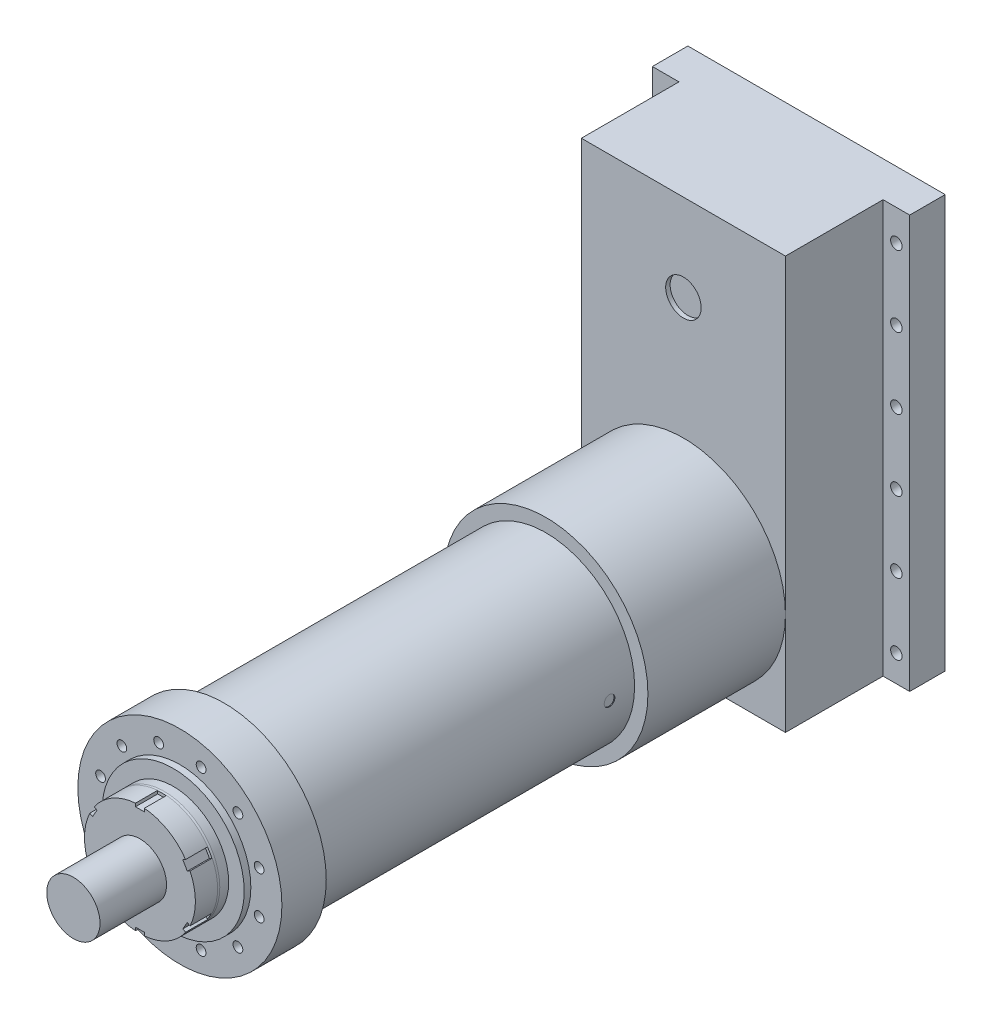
SolidWorks part; units mm, degrees
ref_plane "前视基准面" through (0, 0, 0) normal (0, 0, 1) x (1, 0, 0)
ref_plane "上视基准面" through (0, 0, 0) normal (0, 1, 0) x (1, 0, 0)
ref_plane "右视基准面" through (0, 0, 0) normal (1, 0, 0) x (0, 0, -1)
sketch "草图1" plane through (0, 0, 0) normal (0, 0, 1) x (1, 0, 0)
  circle A0 centre (0, 0) radius 200
  dimension "D1" = 400
extrude "凸台-拉伸1" add sketch "草图1" along normal blind 725
sketch "草图2" plane through (0, 0, 725) normal (0, 0, 1) x (1, 0, 0)
  line L0 (0, 0) -> (351.3656, 0) construction
  line L1 (0, 0) -> (299.4379, 80.2342) construction
  circle A0 centre (0, 0) radius 230
  circle A1 centre (0, 0) radius 185 construction
  circle A2 centre (178.6963, 47.8815) radius 11
  circle A3 centre (178.6963, -47.8815) radius 11
  circle A4 centre (130.8148, -130.8148) radius 11
  circle A5 centre (47.8815, -178.6963) radius 11
  circle A6 centre (-47.8815, -178.6963) radius 11
  circle A7 centre (-130.8148, -130.8148) radius 11
  circle A8 centre (-178.6963, -47.8815) radius 11
  circle A9 centre (-178.6963, 47.8815) radius 11
  circle A10 centre (-130.8148, 130.8148) radius 11
  circle A11 centre (-47.8815, 178.6963) radius 11
  circle A12 centre (47.8815, 178.6963) radius 11
  circle A13 centre (130.8148, 130.8148) radius 11
  point P32 (0, 0)
  dimension "D1" = 460
  dimension "D2" = 370
  dimension "D4" = 22
  dimension "D3" = 15
  dimension "D5" = 12
extrude "凸台-拉伸2" add sketch "草图2" along normal blind 100
sketch "草图3" plane through (0, 0, 825) normal (0, 0, 1) x (1, 0, 0)
  circle A0 centre (0, 0) radius 160
  dimension "D1" = 320
extrude "凸台-拉伸3" add sketch "草图3" along normal blind 15
sketch "草图4" plane through (0, 0, 840) normal (0, 0, 1) x (1, 0, 0)
  circle A1 centre (0, 0) radius 125
  dimension "D1" = 250
extrude "凸台-拉伸4" add sketch "草图4" along normal blind 25
chamfer "倒角1" distance 5 angle 10 1 edges at (125, 0, 865)
sketch "草图5" plane through (0, 0, 865) normal (0, 0, 1) x (1, 0, 0)
  line L0 (-10, 124.5994) -> (-10, 117.5)
  line L1 (-10, 117.5) -> (10, 117.5)
  line L2 (10, 117.5) -> (10, 124.5994)
  line L3 (102.9062, 70.9599) -> (96.758, 67.4103)
  line L4 (96.758, 67.4103) -> (106.758, 50.0897)
  line L5 (106.758, 50.0897) -> (112.9062, 53.6394)
  line L6 (112.9062, -53.6394) -> (106.758, -50.0897)
  line L7 (106.758, -50.0897) -> (96.758, -67.4103)
  line L8 (96.758, -67.4103) -> (102.9062, -70.9599)
  line L9 (10, -124.5994) -> (10, -117.5)
  line L10 (10, -117.5) -> (-10, -117.5)
  line L11 (-10, -117.5) -> (-10, -124.5994)
  line L12 (-102.9062, -70.9599) -> (-96.758, -67.4103)
  line L13 (-96.758, -67.4103) -> (-106.758, -50.0897)
  line L14 (-106.758, -50.0897) -> (-112.9062, -53.6394)
  line L15 (-112.9062, 53.6394) -> (-106.758, 50.0897)
  line L16 (-106.758, 50.0897) -> (-96.758, 67.4103)
  line L17 (-96.758, 67.4103) -> (-102.9062, 70.9599)
  arc A0 (-10, 124.5994) -> (-102.9062, 70.9599) centre (0, 0) ccw
  arc A1 (-112.9062, 53.6394) -> (-112.9062, -53.6394) centre (0, 0) ccw
  arc A2 (-102.9062, -70.9599) -> (-10, -124.5994) centre (0, 0) ccw
  arc A3 (10, -124.5994) -> (102.9062, -70.9599) centre (0, 0) ccw
  arc A4 (112.9062, -53.6394) -> (112.9062, 53.6394) centre (0, 0) ccw
  arc A5 (102.9062, 70.9599) -> (10, 124.5994) centre (0, 0) ccw
  point P28 (0, 0)
  dimension "D1" = 250
  dimension "D2" = 20
  dimension "D3" = 10
  dimension "D4" = 117.5
  dimension "D5" = 6
sketch "草图6" plane through (0, 0, 0) normal (0, 0, -1) x (-1, 0, 0)
  circle A0 centre (0, 0) radius 230
  dimension "D1" = 460
extrude "凸台-拉伸6" add sketch "草图6" along normal blind 310
ref_plane "基准面1" through (-200, 0, 0) normal (1, 0, 0) x (0, 0, -1)
sketch "草图9" plane through (-200, 0, 0) normal (1, 0, 0) x (0, 0, -1)
  line L0 (-725, -200) -> (-725, 200) construction
  circle A0 centre (-36.5, 0) radius 12
  circle A1 centre (-670.5, 0) radius 12
  dimension "D1" = 24
  dimension "D2" = 24
  dimension "D3" = 36.5
  dimension "D4" = 54.5
extrude "切除-拉伸2" cut sketch "草图9" along normal blind 2
ref_plane "基准面2" through (200, 0, 0) normal (1, 0, 0) x (0, 0, -1)
sketch "草图10" plane through (200, 0, 0) normal (1, 0, 0) x (0, 0, -1)
  circle A0 centre (-56.5, 0) radius 12
  dimension "D1" = 56.5
  dimension "D2" = 24
extrude "切除-拉伸3" cut sketch "草图10" against normal blind 2
extrude "凸台-拉伸7" add sketch "草图5" along normal blind 50
sketch "草图11" plane through (0, 0, 915) normal (0, 0, 1) x (1, 0, 0)
  circle A0 centre (0, 0) radius 60
  dimension "D1" = 120
extrude "凸台-拉伸8" add sketch "草图11" along normal blind 150
sketch "草图12" plane through (0, 0, -310) normal (0, 0, -1) x (-1, 0, 0)
  line L1 (-230, 700) -> (230, 700)
  line L2 (-230, 700) -> (-230, -230)
  line L3 (-230, -230) -> (230, -230)
  line L4 (230, 700) -> (230, -230)
  line L5 (-230, 700) -> (230, -230) construction
  line L6 (-230, -230) -> (230, 700) construction
  point P0 (0, 235)
  point P5 (0, 150.9292)
  point P6 (0, 0)
  dimension "D1" = 460
  dimension "D2" = 930
  dimension "D3" = 230
extrude "凸台-拉伸9" add sketch "草图12" along normal blind 220
sketch "草图13" plane through (0, 0, -310) normal (0, 0, 1) x (1, 0, 0)
  line L0 (-230, 700) -> (230, 700) construction
  circle A0 centre (0, 504) radius 40
  dimension "D1" = 80
  dimension "D2" = 196
extrude "切除-拉伸4" cut sketch "草图13" against normal blind 10 contours A0
sketch "草图14" plane through (0, 0, -530) normal (0, 0, -1) x (-1, 0, 0)
  line L0 (-230, -230) -> (230, -230) construction
  line L1 (-290, 700) -> (290, 700)
  line L2 (-290, 700) -> (-290, -230)
  line L3 (-290, -230) -> (290, -230)
  line L4 (290, 700) -> (290, -230)
  line L5 (-290, 700) -> (290, -230) construction
  line L6 (-290, -230) -> (290, 700) construction
  line L7 (0, 235) -> (0, 414.8233) construction
  circle A0 centre (-260, 630) radius 13
  circle A1 centre (-260, 470) radius 13
  circle A2 centre (-260, 310) radius 13
  circle A3 centre (-260, 150) radius 13
  circle A4 centre (-260, -10) radius 13
  circle A5 centre (-260, -170) radius 13
  circle A6 centre (260, -170) radius 13
  circle A7 centre (260, -10) radius 13
  circle A8 centre (260, 150) radius 13
  circle A9 centre (260, 310) radius 13
  circle A10 centre (260, 470) radius 13
  circle A11 centre (260, 630) radius 13
  point P0 (0, 235)
  dimension "D3" = 26
  dimension "D1" = 930
  dimension "D2" = 580
  dimension "D4" = 260
  dimension "D5" = 60
  dimension "D6" = 160
  dimension "D7" = 160
  dimension "D8" = 160
  dimension "D9" = 160
  dimension "D10" = 160
extrude "凸台-拉伸11" add sketch "草图14" along normal blind 80
